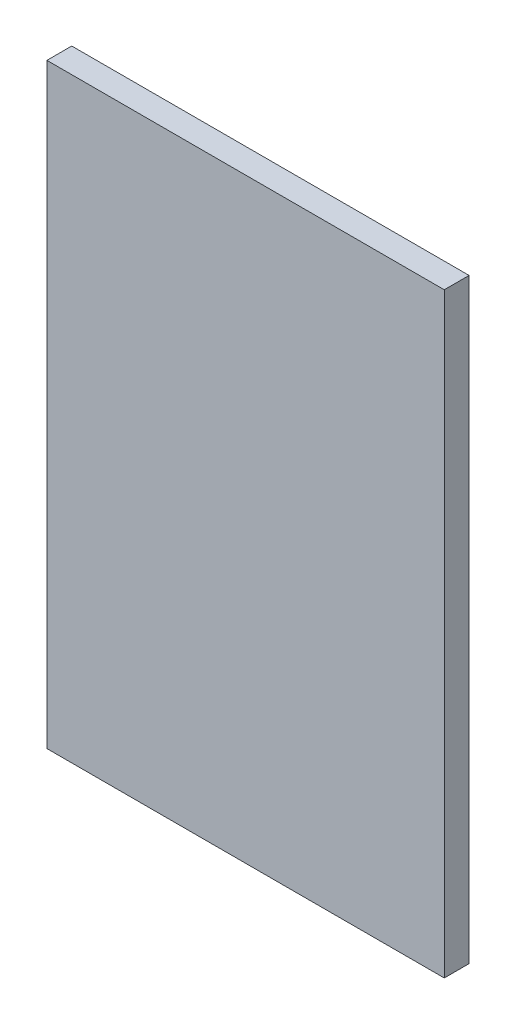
SolidWorks part; units mm, degrees
ref_plane "Front Plane" through (0, 0, 0) normal (0, 0, 1) x (1, 0, 0)
ref_plane "Top Plane" through (0, 0, 0) normal (0, 1, 0) x (1, 0, 0)
ref_plane "Right Plane" through (0, 0, 0) normal (1, 0, 0) x (0, 0, -1)
sketch "Sketch1" plane through (0, 0, 0) normal (0, 0, 1) x (1, 0, 0)
  line L1 (0, 0) -> (304.8, 0)
  line L2 (0, 0) -> (0, 457.2)
  line L3 (0, 457.2) -> (304.8, 457.2)
  line L4 (304.8, 0) -> (304.8, 457.2)
  dimension "D1" = 304.8
  dimension "D2" = 457.2
extrude "Extrude1" add sketch "Sketch1" along normal blind 19.05
